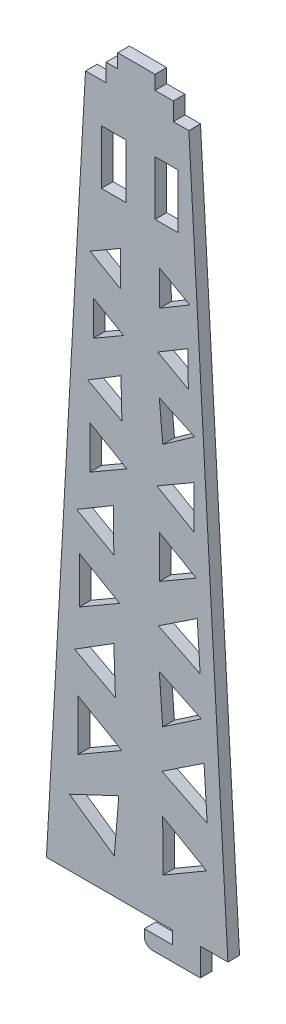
SolidWorks part; units mm, degrees
ref_plane "Alzado" through (0, 0, 0) normal (0, 0, 1) x (1, 0, 0)
ref_plane "Planta" through (0, 0, 0) normal (0, 1, 0) x (1, 0, 0)
ref_plane "Vista lateral" through (0, 0, 0) normal (1, 0, 0) x (0, 0, -1)
sketch "Sketch1" plane through (0, 0, 0) normal (0, 0, 1) x (1, 0, 0)
  line L0 (-23.35, 0) -> (23.35, 0)
  line L1 (16.25, 0) -> (16.25, -7.1)
  line L2 (16.25, -7.1) -> (3.85, -7.1)
  line L3 (1.85, -5.1) -> (1.85, -3.3)
  line L4 (9.05, -3.3) -> (9.05, 0)
  line L5 (1.85, -3.3) -> (9.05, -3.3)
  line L6 (6.6041, 106.9983) -> (14.767, 112.7747)
  line L8 (-13.2999, 180.3) -> (13.3001, 180.3)
  line L9 (-13.2999, 180.3) -> (-23.35, 0)
  line L10 (13.3001, 180.3) -> (23.35, 0)
  line L11 (-7.9999, 180.3) -> (-7.9999, 184.9)
  line L12 (-7.9999, 184.9) -> (9.3001, 184.9)
  line L13 (9.3001, 184.9) -> (9.3001, 180.3)
  line L14 (-4.9999, 184.9) -> (-4.9999, 188.5)
  line L15 (-4.9999, 188.5) -> (4.6001, 188.5)
  line L16 (4.6001, 188.5) -> (4.6001, 184.9)
  line L31 (-13.4442, 177.7111) -> (-13.2999, 180.3)
  line L32 (13.4673, 177.3) -> (14.1661, 164.7625)
  line L39 (6.5742, 24.0314) -> (6.6179, 11.0315)
  line L40 (6.6179, 11.0315) -> (17.8544, 17.5693)
  line L41 (17.8544, 17.5693) -> (6.5742, 24.0314)
  line L42 (16.4922, 50.7867) -> (5.683, 55.9983)
  line L43 (5.683, 55.9983) -> (6.5742, 44.0314)
  line L44 (6.5742, 44.0314) -> (16.4922, 50.7867)
  line L45 (5.683, 75.9983) -> (15.2093, 81.4983)
  line L46 (15.2093, 81.4983) -> (5.683, 86.9983)
  line L47 (5.683, 86.9983) -> (5.683, 75.9983)
  line L48 (14.767, 112.7747) -> (5.683, 116.9558)
  line L49 (5.683, 116.9558) -> (6.6041, 106.9983)
  line L51 (5.7913, 136.9555) -> (13.5308, 141.549)
  line L52 (13.5308, 141.549) -> (5.683, 145.9548)
  line L53 (5.683, 145.9548) -> (5.7913, 136.9555)
  line L55 (13.0462, 131.5584) -> (5.3123, 126.9555)
  line L56 (5.3123, 126.9555) -> (13.1655, 122.5592)
  line L57 (13.1655, 122.5592) -> (13.0462, 131.5584)
  line L59 (5.0611, 96.9983) -> (14.5873, 91.4983)
  line L60 (14.5873, 91.4983) -> (14.5873, 102.4983)
  line L61 (14.5873, 102.4983) -> (5.0611, 96.9983)
  line L62 (15.4605, 72.6303) -> (5.4597, 65.9983)
  line L63 (5.4597, 65.9983) -> (16.2037, 60.6534)
  line L64 (16.2037, 60.6534) -> (15.4605, 72.6303)
  line L65 (6.3796, 34.0314) -> (18.0277, 28.259)
  line L66 (18.0277, 28.259) -> (17.2028, 41.2328)
  line L67 (17.2028, 41.2328) -> (6.3796, 34.0314)
  line L68 (4.6001, 170.1279) -> (10.508, 170.1279)
  line L69 (4.6001, 170.1279) -> (4.6001, 156.1654)
  line L70 (4.6001, 156.1654) -> (10.508, 156.1654)
  line L71 (10.508, 170.1279) -> (10.508, 156.1654)
  line L72 (-2.8374, 170.1279) -> (-9.2202, 170.1279)
  line L73 (-2.8374, 170.1279) -> (-2.8374, 156.1654)
  line L74 (-2.8374, 156.1654) -> (-9.2202, 156.1654)
  line L75 (-9.2202, 170.1279) -> (-9.2202, 156.1654)
  line L76 (-4.317, 145.2186) -> (-12.1172, 140.729)
  line L77 (-12.1172, 140.729) -> (-4.329, 136.2186)
  line L78 (-4.329, 136.2186) -> (-4.317, 145.2186)
  line L79 (-3.5024, 126.2186) -> (-11.2966, 130.7186)
  line L80 (-11.2966, 130.7186) -> (-11.2966, 121.7186)
  line L81 (-11.2966, 121.7186) -> (-3.5024, 126.2186)
  line L82 (-4.1768, 116.933) -> (-12.7097, 111.7186)
  line L83 (-12.7097, 111.7186) -> (-3.9274, 106.9361)
  line L84 (-3.9274, 106.9361) -> (-4.1768, 116.933)
  line L85 (-2.6389, 96.9361) -> (-12.1652, 102.4361)
  line L86 (-12.1652, 102.4361) -> (-12.1652, 91.4361)
  line L87 (-12.1652, 91.4361) -> (-2.6389, 96.9361)
  line L88 (-6.1095, 87.0202) -> (-15.5872, 81.4361)
  line L89 (-15.5872, 81.4361) -> (-6.0123, 76.0202)
  line L90 (-6.0123, 76.0202) -> (-6.1095, 87.0202)
  line L91 (-4.5038, 66.0202) -> (-14.8961, 72.0202)
  line L92 (-14.8961, 72.0202) -> (-14.8961, 60.0202)
  line L93 (-14.8961, 60.0202) -> (-4.5038, 66.0202)
  line L94 (-6.0123, 56.3226) -> (-16.099, 50.0202)
  line L95 (-16.099, 50.0202) -> (-5.5977, 44.4361)
  line L96 (-5.5977, 44.4361) -> (-6.0123, 56.3226)
  line L97 (-3.9264, 33.5202) -> (-15.1847, 40.0202)
  line L98 (-15.1847, 40.0202) -> (-15.1847, 27.0202)
  line L99 (-15.1847, 27.0202) -> (-3.9264, 33.5202)
  line L100 (-4.7331, 23.0209) -> (-17.4344, 17.0202)
  line L101 (-17.4344, 17.0202) -> (-5.887, 9.0209)
  line L102 (-5.887, 9.0209) -> (-4.7331, 23.0209)
  arc A0 (3.85, -7.1) -> (1.85, -5.1) centre (3.85, -5.1) cw
  circle A1 centre (10.3488, 17.5441) radius 7.5056 construction
  circle A2 centre (9.5832, 50.2721) radius 3.4641 construction
  circle A3 centre (8.8584, 81.4983) radius 3.1754 construction
  circle A4 centre (8.3351, 141.4864) radius 2.5981 construction
  circle A5 centre (10.508, 127.0243) radius 2.5981 construction
  circle A6 centre (11.4119, 96.9983) radius 3.1754 construction
  circle A7 centre (12.3746, 66.4273) radius 3.4641 construction
  circle A8 centre (13.87, 34.5077) radius 3.7528 construction
  circle A9 centre (-6.9211, 140.7221) radius 2.5981 construction
  circle A10 centre (-8.6985, 126.2186) radius 2.5981 construction
  circle A11 centre (-6.938, 111.8626) radius 2.8868 construction
  circle A12 centre (-8.9898, 96.9361) radius 3.1754 construction
  circle A13 centre (-9.2363, 81.4922) radius 3.1756 construction
  circle A14 centre (-11.432, 66.0202) radius 3.4641 construction
  circle A15 centre (-9.2363, 50.2596) radius 3.4334 construction
  circle A16 centre (-11.432, 33.5202) radius 3.7528 construction
  circle A17 centre (-9.3515, 16.354) radius 4.0552 construction
  point P4 (0, 0)
  point P19 (0.0001, 180.3)
  point P108 (-17.4344, 16.354)
  dimension "D4" = 2
  dimension "D20" = 0
  dimension "D22" = 20
  dimension "D24" = 10
  dimension "D21" = 20
  dimension "D23" = 10
  dimension "D25" = 10
  dimension "D30" = 9
  dimension "D31" = 11
  dimension "D35" = 9
  dimension "D48" = 10
  dimension "D1" = 46.7
  dimension "D2" = 7.1
  dimension "D3" = 7.1
  dimension "D5" = 3.3
  dimension "D6" = 14.4
  dimension "D7" = 7.2
  dimension "D8" = 20
  dimension "D9" = 4.6
  dimension "D10" = 17.3
  dimension "D11" = 5.3
  dimension "D12" = 8.3
  dimension "D13" = 9.6
  dimension "D14" = 3.6
  dimension "D15" = 180.5799
  dimension "D16" = 6.381
  dimension "D17" = 0
  dimension "D18" = 0
  dimension "D19" = 5.4956
  dimension "D26" = 0
  dimension "D27" = 20
  dimension "D28" = 31.2764
  dimension "D29" = 116.9558
  dimension "D32" = 12
  dimension "D33" = 13
  dimension "D34" = 0
  dimension "D36" = 10
  dimension "D37" = 10
  dimension "D38" = 1.5431
  dimension "D39" = 11
  dimension "D40" = 12
  dimension "D41" = 10
  dimension "D42" = 10
  dimension "D43" = 13
  dimension "D44" = 10
  dimension "D45" = 9
  dimension "D46" = 9
  dimension "D47" = 10
  dimension "D49" = 10
  dimension "D50" = 11
  dimension "D51" = 10
  dimension "D52" = 11
  dimension "D53" = 10
  dimension "D54" = 12
  dimension "D55" = 10
  dimension "D56" = 11.8865
  dimension "D57" = 10
  dimension "D58" = 13
  dimension "D59" = 10
  dimension "D60" = 14
  dimension "D61" = 10
extrude "Boss-Extrude1" add sketch "Sketch1" along normal blind 3 contours L16 L15 L14 L12 | L13 L12 L11 L8 | L10 L8 L9 L0 L102 L101 L100 L99 L98 L97 L96 L95 L94 L93 L92 L91 L90 L89 L88 L87 L86 L85 L84 L83 L82 L81 L80 L79 L78 L77 L76 L75 L72 L73 | A0 L2 L1 L0 L4 L5 L3
